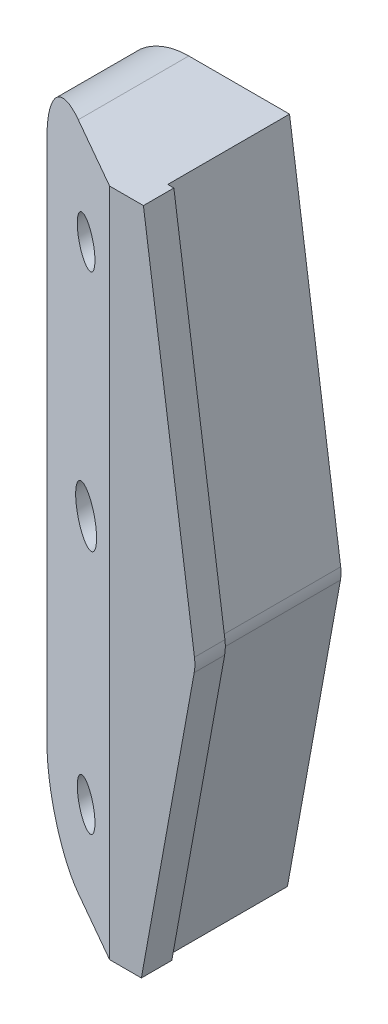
SolidWorks part; units mm, degrees
ref_plane "Frontal" through (0, 0, 0) normal (0, 0, 1) x (1, 0, 0)
ref_plane "Horizontal" through (0, 0, 0) normal (0, 1, 0) x (1, 0, 0)
ref_plane "Profil" through (0, 0, 0) normal (1, 0, 0) x (0, 0, -1)
sketch "Esquisse1" plane through (0, 0, 0) normal (0, 0, 1) x (1, 0, 0)
  line L0 (48.9328, 97.4679) -> (41.6924, 149.3296) construction
  line L1 (48.9328, 97.4679) -> (40.5517, 157.5)
  line L2 (41.6534, 55.4276) -> (48.8873, 95.2489) construction
  line L3 (40.2133, 47.5) -> (48.8873, 95.2489)
  line L4 (11, 59.5) -> (11, 145.5) construction
  line L5 (11, 59.5) -> (11, 145.5)
  line L6 (101, 157.5) -> (0, 157.5) construction
  line L7 (40.5517, 157.5) -> (23, 157.5)
  line L8 (0, 47.5) -> (101, 47.5) construction
  line L9 (23, 47.5) -> (40.2133, 47.5)
  arc A0 (48.8873, 95.2489) -> (48.9328, 97.4679) centre (42, 96.5) ccw construction
  arc A1 (48.8873, 95.2489) -> (48.9328, 97.4679) centre (42, 96.5) ccw
  arc A2 (11, 59.5) -> (23, 47.5) centre (23, 59.5) ccw construction
  arc A3 (11, 59.5) -> (23, 47.5) centre (23, 59.5) ccw
  arc A4 (23, 157.5) -> (11, 145.5) centre (23, 145.5) ccw construction
  arc A5 (23, 157.5) -> (11, 145.5) centre (23, 145.5) ccw
extrude "Base-Extrusion" add sketch "Esquisse1" along normal blind 25
sketch "Esquisse2" plane through (0, 47.5, 0) normal (0, -1, 0) x (1, 0, 0)
  line L0 (0, 5) -> (23, 18.1429) construction
  line L1 (-7.7142, 0.5919) -> (44.6929, 30.5388)
extrude "Enlèv. de mat.-Extru.-Mince1" cut sketch "Esquisse2" against normal through all flip side to cut thin
sketch "Esquisse5" plane through (0, 0, 0) normal (0, 0, -1) x (-1, 0, 0)
  line L5 (-39.2294, 47.6787) -> (-47.9034, 95.4276)
  line L6 (-47.9424, 97.3296) -> (-39.5613, 157.3617)
  line L7 (-37.7025, 39.2738) -> (-47.9034, 95.4276)
  line L8 (-47.9424, 97.3296) -> (-38.0975, 167.8468)
  arc A2 (-47.9424, 97.3296) -> (-47.9034, 95.4276) centre (-42, 96.5) ccw
  arc A3 (-47.9424, 97.3296) -> (-47.9034, 95.4276) centre (-42, 96.5) ccw
  dimension "D1" = 1
extrude "Enlèv. de mat.-Extru.-Mince5" cut sketch "Esquisse5" against normal blind 20 thin
sketch "Esquisse6" plane through (0, 0, 0) normal (0, 0, -1) x (-1, 0, 0)
  line L0 (-39.542, 157.5) -> (-23, 157.5) construction
  line L1 (-11, 145.5) -> (-11, 59.5) construction
  line L2 (-23, 47.5) -> (-39.1969, 47.5) construction
  circle A0 centre (-26, 142.5) radius 3.375
  circle A1 centre (-26, 103.5) radius 4
  circle A2 centre (-26, 62.5) radius 3.375
  dimension "D1" = 6.75
  dimension "D4" = 8
  dimension "D2" = 15
  dimension "D3" = 15
  dimension "D5" = 15
  dimension "D6" = 56
extrude "Enlèv. mat.-Extru.1" cut sketch "Esquisse6" against normal through all
